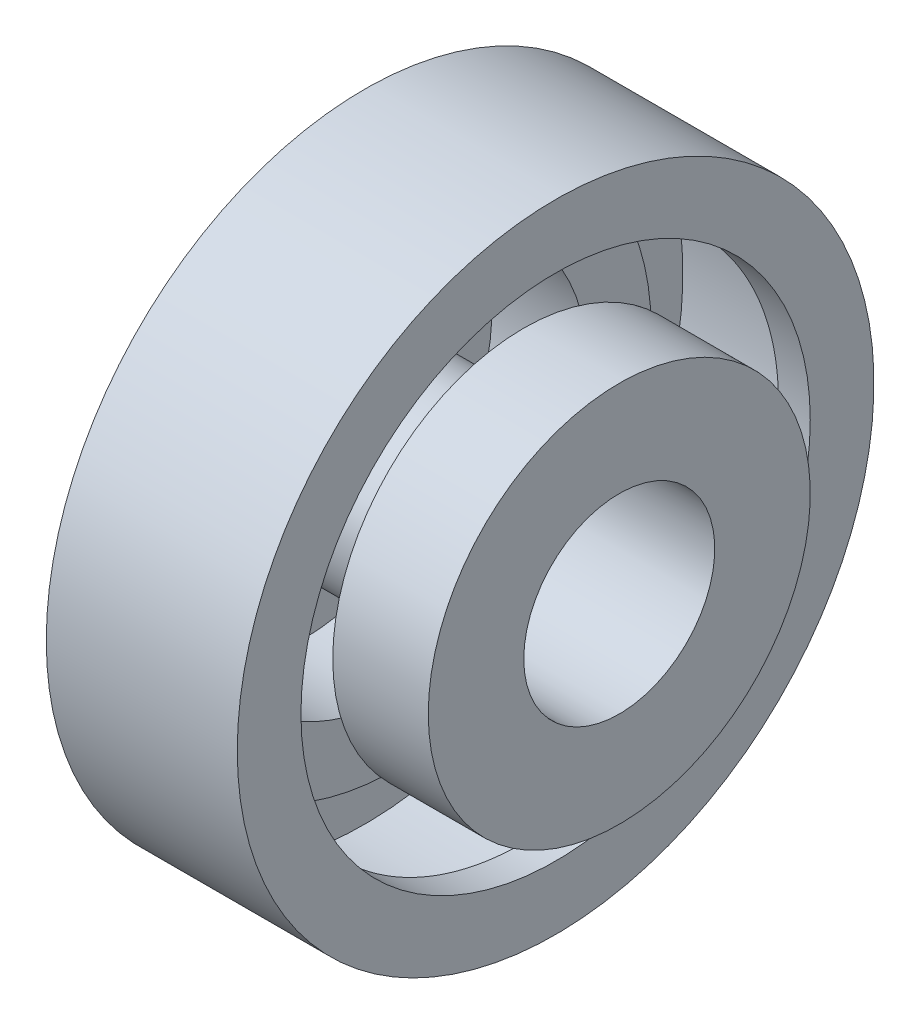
SolidWorks part; units mm, degrees
ref_plane "Front Plane" through (0, 0, 0) normal (0, 0, 1) x (1, 0, 0)
ref_plane "Top Plane" through (0, 0, 0) normal (0, 1, 0) x (1, 0, 0)
ref_plane "Right Plane" through (0, 0, 0) normal (1, 0, 0) x (0, 0, -1)
sketch "Sketch1" plane through (0, 0, 0) normal (0, 0, 1) x (1, 0, 0)
  line L0 (-5.7575, 0) -> (16.7609, 0) construction
  line L1 (0, 19.9595) -> (0, -6.9091) construction
  line L2 (-5, 3) -> (5, 3)
  line L3 (5, 3) -> (5, 6)
  line L4 (5, 6) -> (2, 6)
  line L5 (2, 6) -> (2, 8)
  line L6 (2, 8) -> (3, 8)
  line L7 (3, 8) -> (3, 10)
  line L8 (3, 10) -> (-3, 10)
  line L9 (-3, 8) -> (-3, 10)
  line L10 (-2, 8) -> (-3, 8)
  line L11 (-2, 6) -> (-2, 8)
  line L12 (-5, 6) -> (-2, 6)
  line L13 (-5, 3) -> (-5, 6)
  point P16 (0, 10)
  point P21 (0, 3)
  dimension "D1" = 10
  dimension "D2" = 3
  dimension "D3" = 3
  dimension "D4" = 10
  dimension "D5" = 2
  dimension "D6" = 4
  dimension "D7" = 6
revolve "Revolve1" add sketch "Sketch1" angle 360 about L0
sketch "Sketch3" plane through (2, 0, 0) normal (1, 0, 0) x (0, 0, -1)
  line L0 (0, 8.7718) -> (0, -9.5744) construction
  circle A0 centre (7, 0) radius 1
  dimension "D1" = 2
  dimension "D2" = 7
extrude "Extrude2" cut sketch "Sketch3" against normal through all
